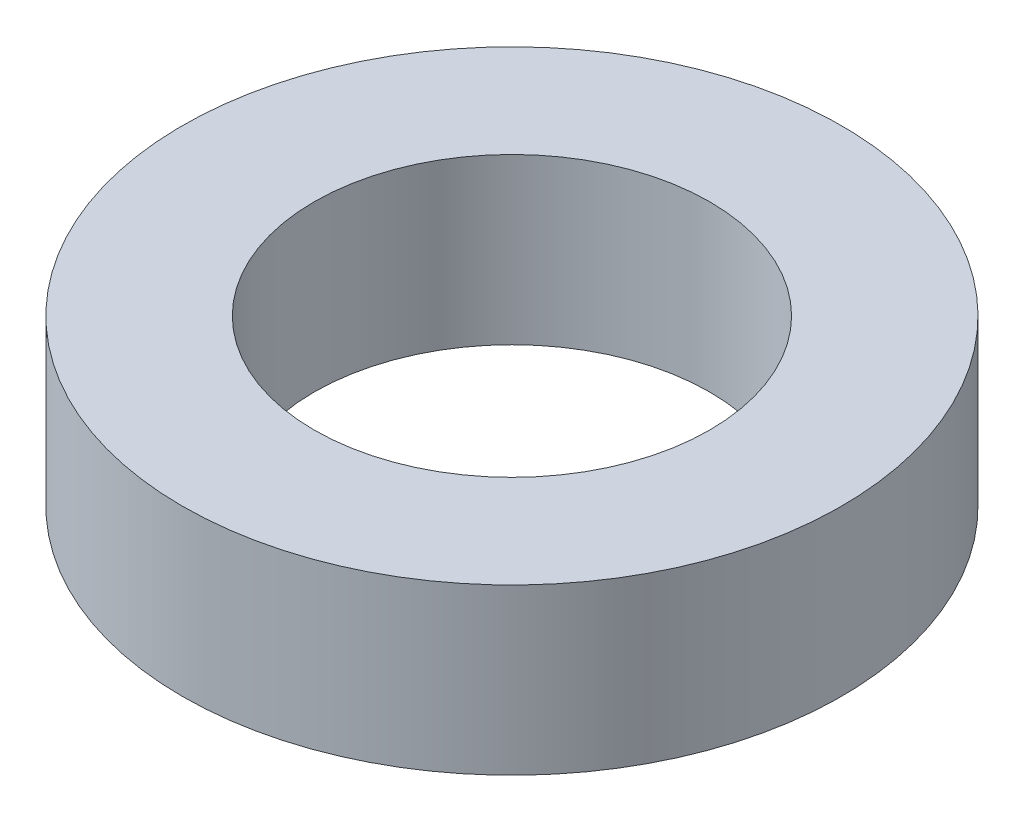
SolidWorks part; units mm, degrees
ref_plane "Plan de face" through (0, 0, 0) normal (0, 0, 1) x (1, 0, 0)
ref_plane "Plan de dessus" through (0, 0, 0) normal (0, 1, 0) x (1, 0, 0)
ref_plane "Plan de droite" through (0, 0, 0) normal (1, 0, 0) x (0, 0, -1)
sketch "Esquisse1" plane through (0, 0, 0) normal (0, 1, 0) x (1, 0, 0)
  circle A0 centre (0, 0) radius 40
  circle A1 centre (0, 0) radius 24
  dimension "D1" = 80
  dimension "D2" = 48
extrude "Extrusion1" add sketch "Esquisse1" along normal blind 20
